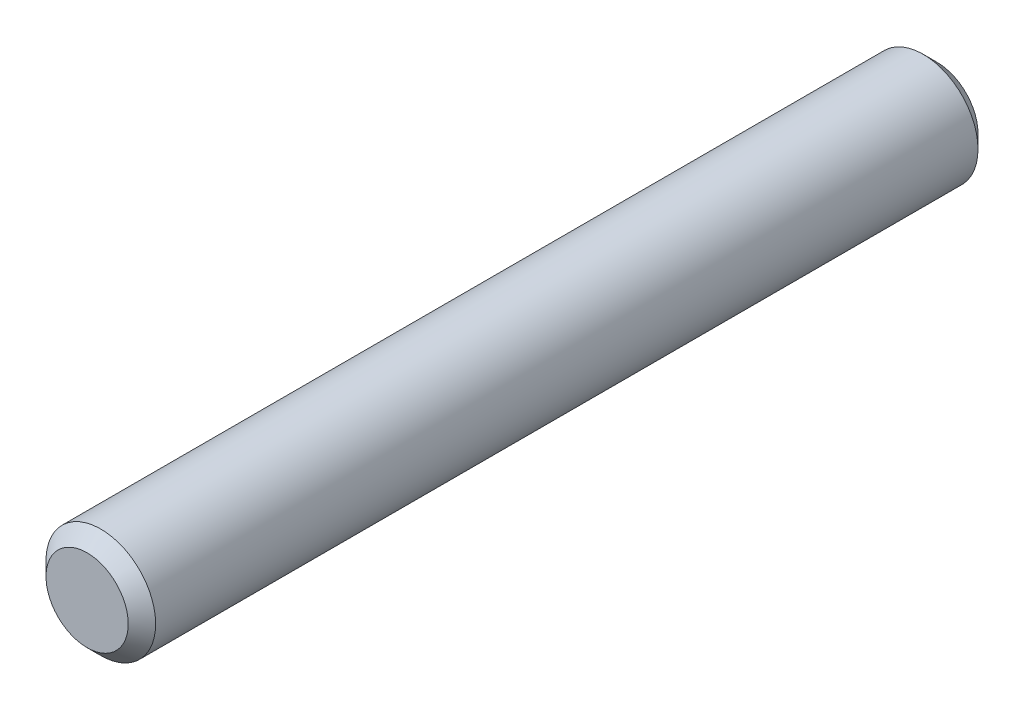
SolidWorks part; units mm, degrees
ref_plane "Plane1" through (0, 0, 0) normal (0, 0, 1) x (1, 0, 0)
ref_plane "Plane2" through (0, 0, 0) normal (0, 1, 0) x (1, 0, 0)
ref_plane "Plane3" through (0, 0, 0) normal (1, 0, 0) x (0, 0, -1)
sketch "Esquisse1" plane through (0, 0, 0) normal (0, 0, 1) x (1, 0, 0)
  circle A0 centre (0, 0) radius 2
  dimension "D1" = 4
extrude "Base-Extrusion" add sketch "Esquisse1" along normal blind 31
chamfer "Chanfrein1" distance 0.5 angle 45
chamfer "Chanfrein2" distance 0.5 angle 45
